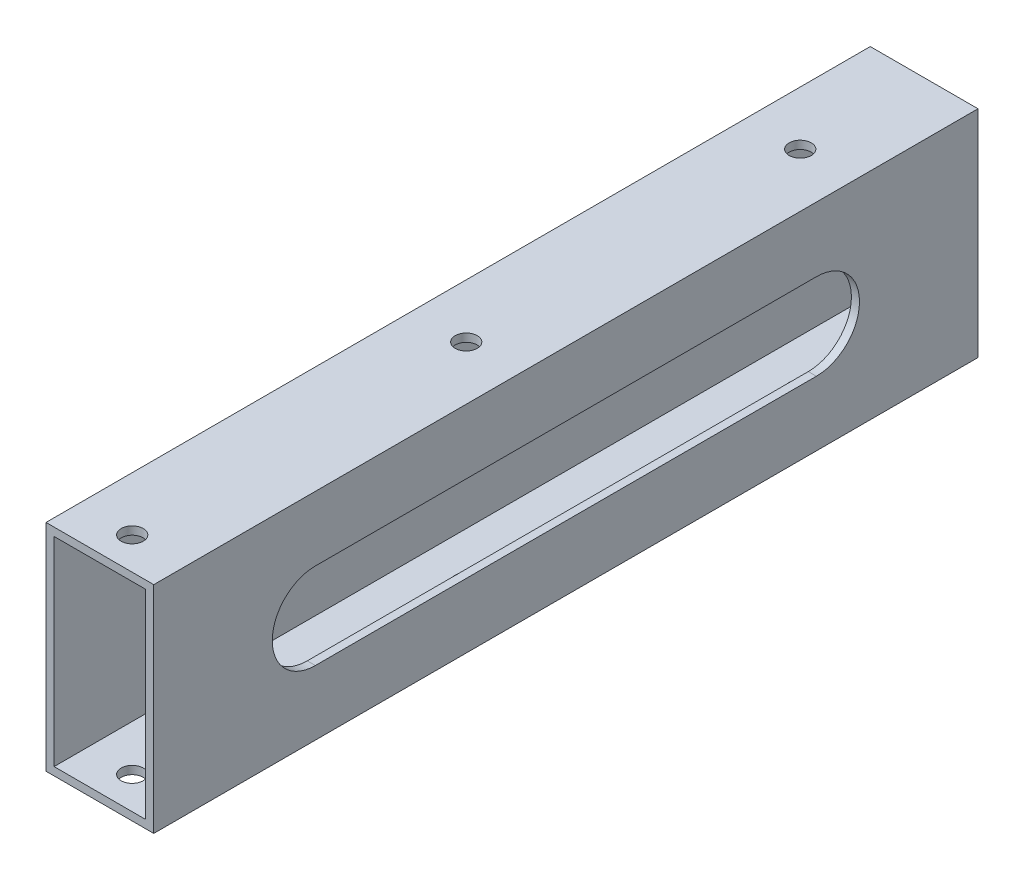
SolidWorks part; units mm, degrees
ref_plane "前视基准面" through (0, 0, 0) normal (0, 0, 1) x (1, 0, 0)
ref_plane "上视基准面" through (0, 0, 0) normal (0, 1, 0) x (1, 0, 0)
ref_plane "右视基准面" through (0, 0, 0) normal (1, 0, 0) x (0, 0, -1)
sketch "草图1" plane through (0, 0, 0) normal (0, 0, 1) x (1, 0, 0)
  line L0 (-8.5, 18.5) -> (8.5, 18.5)
  line L1 (-10, -20) -> (10, -20)
  line L2 (-10, -20) -> (-10, 20)
  line L3 (-10, 20) -> (10, 20)
  line L4 (10, -20) -> (10, 20)
  line L5 (-10, -20) -> (10, 20) construction
  line L6 (-10, 20) -> (10, -20) construction
  line L7 (8.5, -18.5) -> (8.5, 18.5)
  line L8 (-8.5, -18.5) -> (8.5, -18.5)
  line L9 (-8.5, -18.5) -> (-8.5, 18.5)
  point P0 (0, 0)
  dimension "D1" = 20
  dimension "D2" = 40
  dimension "D3" = 1.5
extrude "凸台-拉伸1" add sketch "草图1" along normal blind 170
sketch "草图2" plane through (0, 20, 0) normal (0, 1, 0) x (1, 0, 0)
  line L0 (0, 0) -> (0, -170) construction
  line L1 (10, -170) -> (-10, -170) construction
  line L2 (10, 0) -> (-10, 0) construction
  circle A0 centre (0, -147) radius 2.05
  circle A1 centre (0, -23) radius 2.05
  circle A2 centre (0, -85) radius 2.05
  dimension "D1" = 4.1
  dimension "D2" = 23
  dimension "D3" = 23
extrude "切除-拉伸1" cut sketch "草图2" against normal blind 220
sketch "草图3" plane through (-10, 0, 0) normal (-1, 0, 0) x (0, 0, 1)
  line L0 (170, -20) -> (0, -20) construction
  line L1 (170, 20) -> (153, 20)
  line L2 (170, 20) -> (170, -20)
  line L3 (170, -20) -> (153, -20)
  line L4 (153, 20) -> (153, -20)
  dimension "D1" = 17
extrude "切除-拉伸2" cut sketch "草图3" against normal up to surface (20 mm away)
sketch "草图4" plane through (10, 0, 0) normal (1, 0, 0) x (0, 0, -1)
  line L0 (-153, 0) -> (0, 0) construction
  line L1 (-153, -20) -> (-153, 20) construction
  line L2 (-123, 0) -> (-30, 0) construction
  line L3 (-123, 8) -> (-30, 8)
  line L4 (-123, -8) -> (-30, -8)
  line L5 (0, -20) -> (0, 20) construction
  arc A0 (-123, 8) -> (-123, -8) centre (-123, 0) ccw
  arc A1 (-30, -8) -> (-30, 8) centre (-30, 0) ccw
  point P7 (-76.5, 0)
  dimension "D1" = 8
  dimension "D2" = 30
  dimension "D3" = 30
extrude "切除-拉伸3" cut sketch "草图4" against normal blind 59
